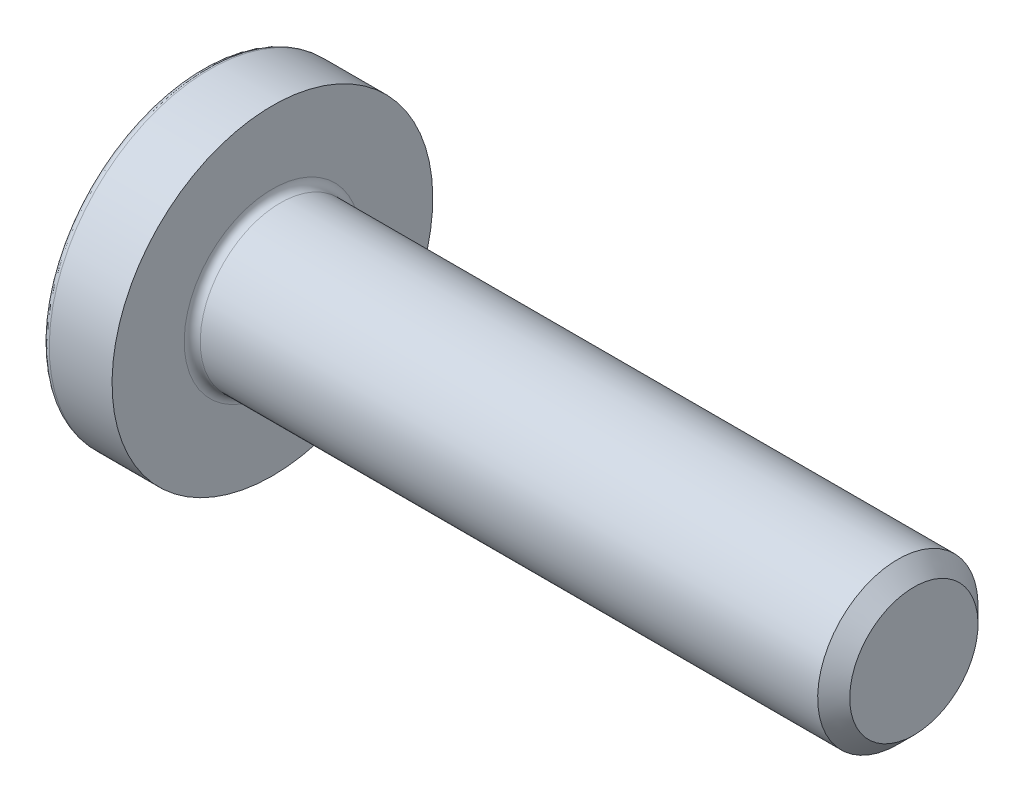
SolidWorks part; units mm, degrees
ref_plane "Plan de face" through (0, 0, 0) normal (0, 0, 1) x (1, 0, 0)
ref_plane "Plan de dessus" through (0, 0, 0) normal (0, 1, 0) x (1, 0, 0)
ref_plane "Plan de droite" through (0, 0, 0) normal (1, 0, 0) x (0, 0, -1)
sketch "Esquisse1" plane through (0, 0, 0) normal (0, 0, 1) x (1, 0, 0)
  line L0 (-2.3486, 6) -> (0, 6)
  line L1 (0, 6) -> (0, 3.3)
  line L2 (0.3, 3) -> (23.4, 3)
  line L3 (23.4, 3) -> (24, 2.4)
  line L4 (24, 2.4) -> (24, 0)
  line L5 (24, 0) -> (-4.5, 0)
  line L6 (-13.1907, 0) -> (21.173, 0) construction
  arc A0 (-2.5913, 5.8763) -> (-4.5, 0) centre (5.5, 0) ccw
  arc A1 (0, 3.3) -> (0.3, 3) centre (0.3, 3.3) ccw
  arc A2 (-2.3486, 6) -> (-2.5913, 5.8763) centre (-2.3486, 5.7) ccw
  dimension "D1" = 6
  dimension "D4" = 10
  dimension "D8" = 0.3
  dimension "D9" = 0.3
  dimension "D2" = 12
  dimension "D3" = 4.5
  dimension "D5" = 24
  dimension "D6" = 0.6
  dimension "D7" = 0.6
revolve "Révolution1" add sketch "Esquisse1" angle 360 about L6
ref_plane "Plan1" through (-4.5, 0, 0) normal (-1, 0, 0) x (0, 0, 1)
sketch "Esquisse2" plane through (-4.5, 0, 0) normal (-1, 0, 0) x (0, 0, 1)
  line L1 (-0.75, -3.1) -> (0.75, -3.1)
  line L2 (-0.75, -3.1) -> (-0.75, 3.1)
  line L3 (-0.75, 3.1) -> (0.75, 3.1)
  line L4 (0.75, -3.1) -> (0.75, 3.1)
  line L5 (-0.75, -3.1) -> (0.75, 3.1) construction
  line L6 (-0.75, 3.1) -> (0.75, -3.1) construction
  point P0 (0, 0)
  dimension "D1" = 6.2
  dimension "D2" = 1.5
ref_plane "Plan2" through (-1, 0, 0) normal (-1, 0, 0) x (0, 0, 1)
sketch "Esquisse3" plane through (-1, 0, 0) normal (-1, 0, 0) x (0, 0, 1)
  line L0 (0.75, -3.1) -> (0.75, 3.1) construction
  line L1 (-0.75, -1.5) -> (0.75, -1.5)
  line L2 (-0.75, -1.5) -> (-0.75, 1.5)
  line L3 (-0.75, 1.5) -> (0.75, 1.5)
  line L4 (0.75, -1.5) -> (0.75, 1.5)
  line L5 (-0.75, -1.5) -> (0.75, 1.5) construction
  line L6 (-0.75, 1.5) -> (0.75, -1.5) construction
  point P0 (0, 0)
  dimension "D1" = 3
loft "Enlèvement de matière-Lissage1" cut profiles "Esquisse3", "Esquisse2"
pattern_circular "Répétition circulaire1" count 2 every 90 about axis through (0, 0, 0) along (1, 0, 0) of "Enlèvement de matière-Lissage1"
sketch "Esquisse4" plane through (-4.5, 0, 0) normal (-1, 0, 0) x (0, 0, 1)
  circle A0 centre (0, 0) radius 1.5
  dimension "D1" = 3
extrude "Enlèv. mat.-Extru.2" cut sketch "Esquisse4" against normal up to surface (3.5 mm away) draft 4
